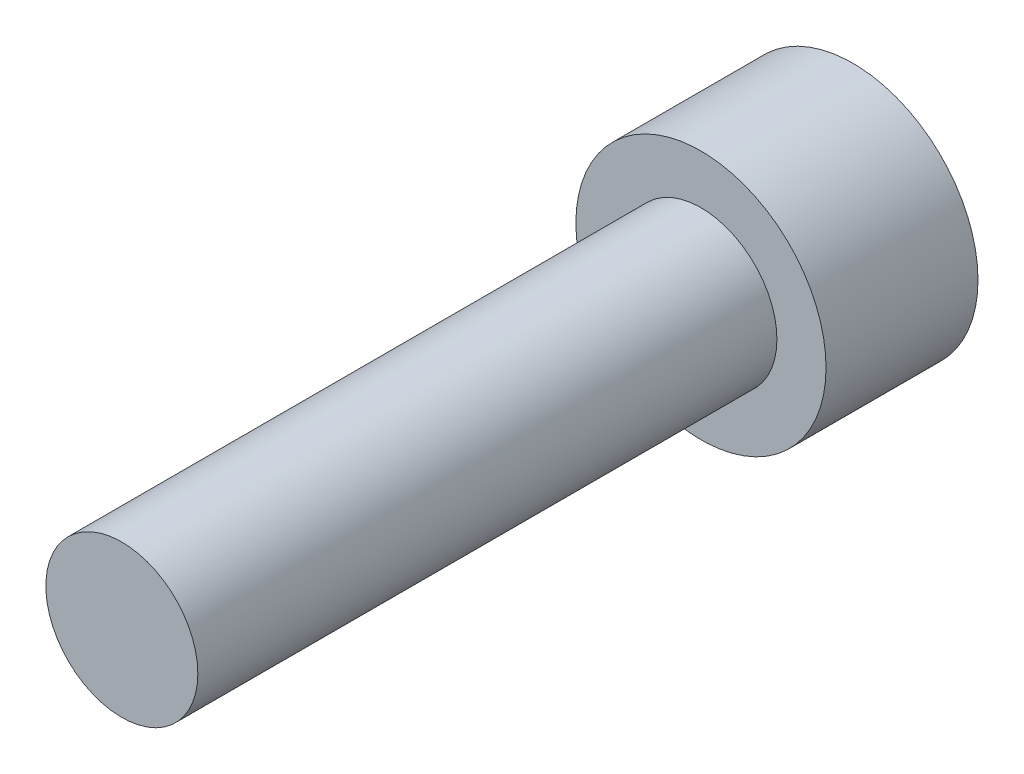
SolidWorks part; units mm, degrees
ref_plane "Front Plane" through (0, 0, 0) normal (0, 0, 1) x (1, 0, 0)
ref_plane "Top Plane" through (0, 0, 0) normal (0, 1, 0) x (1, 0, 0)
ref_plane "Right Plane" through (0, 0, 0) normal (1, 0, 0) x (0, 0, -1)
sketch "Sketch6" plane through (0, 0, 0) normal (1, 0, 0) x (0, 0, -1)
  line L0 (-15.875, 0) -> (22.525, 0) construction
  line L1 (3.7719, 0) -> (-3.7719, 0) construction
  line L2 (-15.875, 0) -> (-15.875, -2.0828)
  line L3 (-15.875, -2.0828) -> (0, -2.0828)
  line L4 (0, 3.7719) -> (0, -3.7719) construction
  line L5 (0, -2.0828) -> (0, -3.429)
  line L6 (0, -3.429) -> (4.1656, -3.429)
  line L7 (4.1656, -3.429) -> (4.1656, 0)
  line L8 (4.1656, 0) -> (-15.875, 0)
  dimension "L" = 15.875
  dimension "H" = 4.1656
  dimension "A" = 6.858
  dimension "D" = 4.1656
revolve "Revolve1" add sketch "Sketch6" angle 360 about L0
sketch "Sketch7" plane through (0, 0, -4.1656) normal (0, 0, -1) x (-1, 0, 0)
  line L2 (-1.778, 1.0265) -> (-1.778, -1.0265)
  line L4 (-1.778, -1.0265) -> (0, -2.0531)
  line L5 (0, -2.0531) -> (1.778, -1.0265)
  line L6 (1.778, -1.0265) -> (1.778, 1.0265)
  line L7 (1.778, 1.0265) -> (0, 2.0531)
  line L8 (0, 2.0531) -> (-1.778, 1.0265)
  circle A0 centre (0, 0) radius 1.778 construction
  dimension "J" = 3.556
extrude "HEX" cut sketch "Sketch7" against normal blind 2.794
